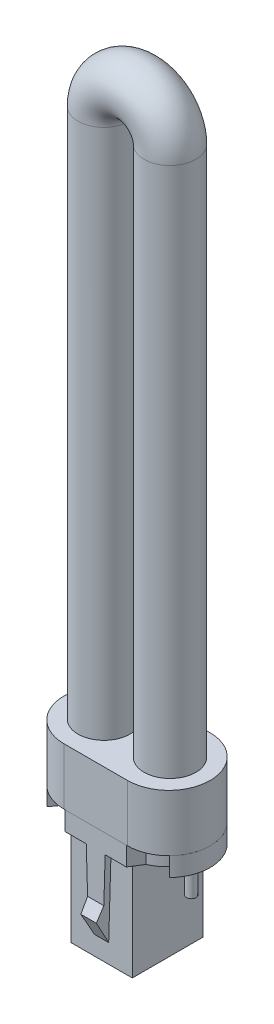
SolidWorks part; units mm, degrees
ref_plane "Front Plane" through (0, 0, 0) normal (0, 0, 1) x (1, 0, 0)
ref_plane "Top Plane" through (0, 0, 0) normal (0, 1, 0) x (1, 0, 0)
ref_plane "Right Plane" through (0, 0, 0) normal (1, 0, 0) x (0, 0, -1)
sketch "Sketch1" plane through (0, 0, 0) normal (0, 0, 1) x (1, 0, 0)
  line L0 (12.5, 0) -> (-12.5, 0) construction
  line L1 (-12.5, 0) -> (-12.5, 112.5) construction
  line L2 (12.5, 0) -> (12.5, 112.5) construction
  line L3 (-1.5, 0) -> (-1.5, 112.5) construction
  line L4 (1.5, 0) -> (1.5, 112.5) construction
  line L5 (-7, 0) -> (-7, 112.5)
  line L6 (7, 0) -> (7, 112.5)
  arc A0 (12.5, 112.5) -> (-12.5, 112.5) centre (0, 112.5) ccw construction
  arc A1 (1.5, 112.5) -> (-1.5, 112.5) centre (0, 112.5) ccw construction
  arc A2 (7, 112.5) -> (-7, 112.5) centre (0, 112.5) ccw
  point P4 (0, 0)
  point P8 (0, 125)
  point P19 (0, 0)
  dimension "D2" = 125
  dimension "D1" = 25
  dimension "D3" = 11
  dimension "D4" = 5.5
sketch "Sketch2" plane through (0, 0, 0) normal (0, 1, 0) x (1, 0, 0)
  circle A0 centre (7, 0) radius 5.5
  point P0 (7, 0)
  dimension "D1" = 11
sweep "Sweep1" add profiles "Sketch2" path "Sketch1"
sketch "Sketch3" plane through (0, 0, 0) normal (0, 1, 0) x (1, 0, 0)
  line L0 (-6.75, 0) -> (6.75, 0) construction
  line L1 (-6.75, 8.75) -> (6.75, 8.75)
  line L2 (-6.75, -8.75) -> (6.75, -8.75)
  arc A0 (-6.75, 8.75) -> (-6.75, -8.75) centre (-6.75, 0) ccw
  arc A1 (6.75, -8.75) -> (6.75, 8.75) centre (6.75, 0) ccw
  point P2 (0, 0)
  point P7 (15.5, 0)
  point P8 (-15.5, 0)
  dimension "D1" = 17.5
  dimension "D2" = 31
extrude "Boss-Extrude1" add sketch "Sketch3" against normal blind 12 separate body
sketch "Sketch4" plane through (0, -12, 0) normal (0, -1, 0) x (1, 0, 0)
  line L0 (-6.75, 8.75) -> (6.75, 8.75) construction
  line L1 (-6.5, 8.75) -> (6.5, 8.75)
  line L2 (-6.5, 8.75) -> (-6.5, -8.75) construction
  line L3 (-6.5, -8.75) -> (6.5, -8.75) construction
  line L4 (6.5, 8.75) -> (6.5, -8.75) construction
  line L5 (6.75, -8.75) -> (-6.75, -8.75) construction
  line L6 (0, 0) -> (0, 8.75) construction
  line L7 (-15.5, 0) -> (15.5, 0) construction
  line L8 (-11.5, 0) -> (11.5, 0) construction
  line L9 (-6.5, 8.75) -> (-8.0998, 6.2122)
  line L10 (-11.2895, 3.7985) -> (-12.992, 6.1319)
  line L11 (6.5, 8.75) -> (8.0998, 6.2122)
  line L12 (11.2895, 3.7985) -> (12.992, 6.1319)
  line L13 (11.2895, -3.7985) -> (12.992, -6.1319)
  line L14 (6.5, -8.75) -> (8.0998, -6.2122)
  line L15 (-6.5, -8.75) -> (6.5, -8.75)
  line L16 (-6.5, -8.75) -> (-8.0998, -6.2122)
  line L17 (-11.2895, -3.7985) -> (-12.992, -6.1319)
  arc A1 (8.0998, 6.2122) -> (11.2895, 3.7985) centre (4.7097, -1.5825) cw
  arc A2 (-6.75, 8.75) -> (-6.75, -8.75) centre (-6.75, 0) ccw construction
  arc A3 (-12.992, 6.1319) -> (-12.992, -6.1319) centre (-6.75, 0) ccw
  circle A4 centre (-11.5, 0) radius 1 construction
  arc A5 (-8.0998, 6.2122) -> (-11.2895, 3.7985) centre (-4.7097, -1.5825) ccw
  arc A6 (12.992, 6.1319) -> (12.992, -6.1319) centre (6.75, 0) cw
  arc A7 (8.0998, -6.2122) -> (11.2895, -3.7985) centre (4.7097, 1.5825) ccw
  arc A8 (-8.0998, -6.2122) -> (-11.2895, -3.7985) centre (-4.7097, 1.5825) cw
  point P15 (-11.5, 3.4526)
  point P22 (0, 0)
  dimension "D2" = 2
  dimension "D6" = 17
  dimension "D1" = 23
  dimension "D3" = 13
  dimension "D4" = 3
  dimension "D5" = 7
  dimension "D7" = 10.3325
  dimension "D9" = 4
extrude "Boss-Extrude2" add sketch "Sketch4" along normal blind 4 separate body
sketch "Sketch5" plane through (0, -16, 0) normal (0, -1, 0) x (1, 0, 0)
  line L1 (6.5, -7.5) -> (-6.5, -7.5)
  line L2 (6.5, -7.5) -> (6.5, 7.5)
  line L3 (6.5, 7.5) -> (-6.5, 7.5)
  line L4 (-6.5, -7.5) -> (-6.5, 7.5)
  line L5 (6.5, -7.5) -> (-6.5, 7.5) construction
  line L6 (6.5, 7.5) -> (-6.5, -7.5) construction
  point P0 (0, 0)
  dimension "D1" = 13
  dimension "D2" = 15
extrude "Boss-Extrude3" add sketch "Sketch5" along normal blind 21 separate body
sketch "Sketch6" plane through (0, -16, 0) normal (0, -1, 0) x (1, 0, 0)
  line L0 (11.5, 0) -> (-11.5, 0) construction
  circle A0 centre (-11.5, 0) radius 1
  circle A1 centre (11.5, 0) radius 1
  point P4 (0, 0)
  dimension "D2" = 2
  dimension "D1" = 23
extrude "Boss-Extrude4" add sketch "Sketch6" along normal blind 7 separate body
sketch "Sketch8" plane through (0, 0, 7.5) normal (0, 0, 1) x (1, 0, 0)
  line L0 (0, 0) -> (0, -16) construction
  line L1 (1.5, -33) -> (-1.5, -33)
  line L2 (-1.5, -33) -> (-2, -16)
  line L3 (-2, -16) -> (2, -16)
  line L4 (2, -16) -> (1.5, -33)
  line L5 (0, -33) -> (0, -16) construction
  line L6 (6.5, -16) -> (-6.5, -16) construction
  point P1 (0, -18.9777)
  point P9 (0, 0)
  point P10 (0, -32.6243)
  point P13 (1.5508, -30.025)
  dimension "D1" = 4
  dimension "D2" = 17
  dimension "D3" = 3
extrude "Boss-Extrude5" add sketch "Sketch8" along normal up to surface (16.25 mm away)
mirror "Mirror1" about plane through (0, 0, 0) normal (0, 0, 1) of "Boss-Extrude5"
sketch "Sketch9" plane through (0, 0, -7.5) normal (0, 0, -1) x (-1, 0, 0)
  line L4 (-1.5, -33) -> (1.5, -33)
  line L5 (1.5, -33) -> (2, -16)
  line L6 (2, -16) -> (-2, -16)
  line L7 (-2, -16) -> (-1.5, -33)
  line L8 (-1.5, -33) -> (1.5, -33)
  line L9 (1.5, -33) -> (2, -16)
  line L10 (2, -16) -> (-2, -16)
  line L11 (-2, -16) -> (-1.5, -33)
  dimension "D1" = 0
extrude "Boss-Extrude6" add sketch "Sketch9" along normal up to surface (1.25 mm away)
sketch "Sketch10" plane through (0, 0, 0) normal (1, 0, 0) x (0, 0, -1)
  line L0 (-8.75, -30.7273) -> (-10.25, -28)
  line L2 (-10.25, -28) -> (-8.75, -25.5)
  line L3 (-8.75, -33) -> (-8.75, -16) construction
  line L4 (0, 0) -> (0, -37) construction
  line L5 (-7.5, -37) -> (7.5, -37) construction
  line L6 (8.75, -30.7273) -> (10.25, -28)
  line L7 (10.25, -28) -> (8.75, -25.5)
  line L8 (8.75, -25.5) -> (8.75, -30.7273)
  line L9 (8.75, -16) -> (8.75, -33) construction
  line L10 (-8.75, -25.5) -> (-8.75, -30.7273)
  line L11 (-7.5, -33) -> (-8.75, -30.7273) construction
  line L12 (8.75, -30.7273) -> (7.5, -33) construction
  dimension "D1" = 5
  dimension "D2" = 20.5
  dimension "D3" = 7.5
extrude "Boss-Extrude7" add sketch "Sketch10" along normal up to surface and the other way up to surface
sketch "Sketch11" plane through (0, 0, 0) normal (1, 0, 0) x (0, 0, -1)
  line L0 (-7.5, -33) -> (-8.75, -30.7273)
  line L1 (-8.75, -30.7273) -> (-8.75, -33)
  line L2 (-8.75, -33) -> (-7.5, -33)
  line L3 (0, 0) -> (0, -37) construction
  line L4 (-7.5, -37) -> (7.5, -37) construction
  line L5 (8.75, -33) -> (7.5, -33)
  line L6 (7.5, -33) -> (8.75, -30.7273)
  line L7 (8.75, -30.7273) -> (8.75, -33)
extrude "Cut-Extrude1" cut sketch "Sketch11" against normal up to next and the other way up to next
